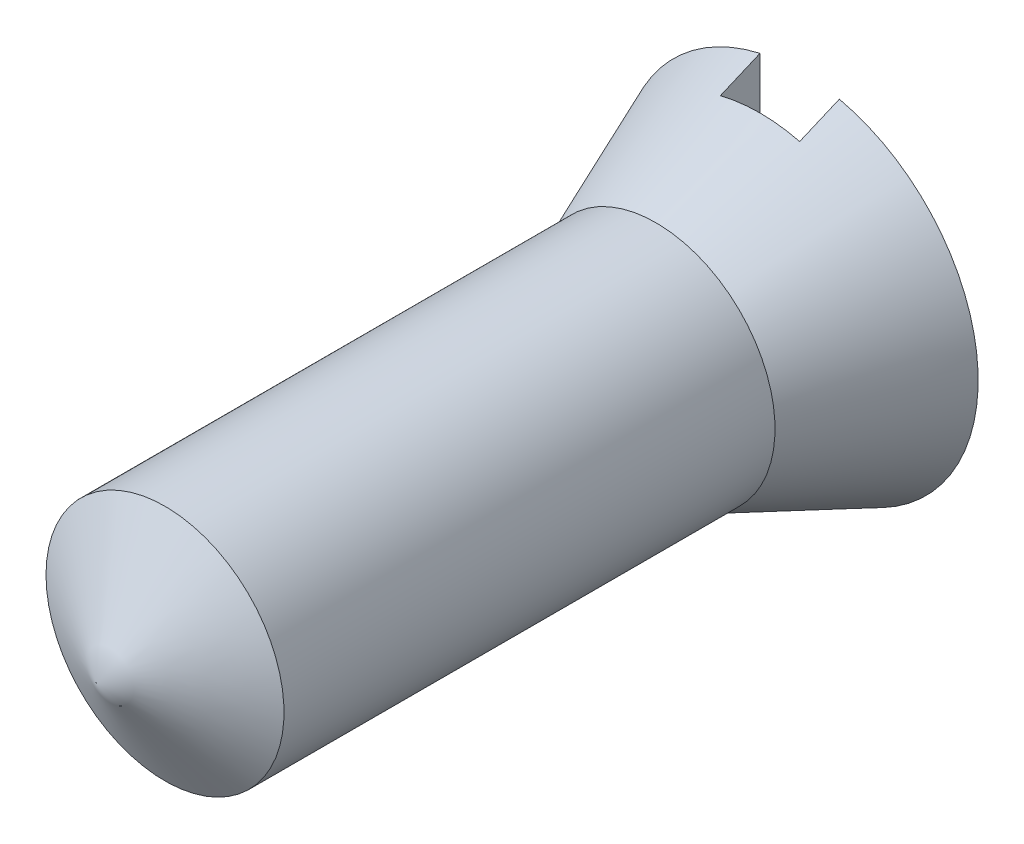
SolidWorks part; units mm, degrees
ref_plane "Front Plane" through (0, 0, 0) normal (0, 0, 1) x (1, 0, 0)
ref_plane "Top Plane" through (0, 0, 0) normal (0, 1, 0) x (1, 0, 0)
ref_plane "Right Plane" through (0, 0, 0) normal (1, 0, 0) x (0, 0, -1)
sketch "Sketch1" plane through (0, 0, 0) normal (0, 1, 0) x (1, 0, 0)
  line L0 (0, 0) -> (0, 17.7321)
  line L1 (0, 17.7321) -> (4.5, 17.7321)
  line L2 (4.5, 17.7321) -> (3, 14.1107)
  line L3 (3, 14.1107) -> (3, 1.7321)
  line L4 (3, 1.7321) -> (0, 0)
  line L5 (0, 0) -> (0, -5.5994) construction
  line L6 (13.1251, 17.7321) -> (4.5, 17.7321) construction
  line L7 (4.5, 17.7321) -> (7.4834, 24.9345) construction
  line L8 (-4.5, 17.7321) -> (-3, 14.1107) construction
  dimension "D1" = 9
  dimension "D2" = 6
  dimension "D3" = 120
  dimension "D4" = 16
  dimension "D5" = 45
revolve "Revolve1" add sketch "Sketch1" angle 360 about L5
sketch "Sketch2" plane through (0, 0, -17.7321) normal (0, 0, -1) x (-1, 0, 0)
  line L1 (-1, -5.2264) -> (1, -5.2264)
  line L2 (-1, -5.2264) -> (-1, 5.2264)
  line L3 (-1, 5.2264) -> (1, 5.2264)
  line L4 (1, -5.2264) -> (1, 5.2264)
  line L5 (-1, -5.2264) -> (1, 5.2264) construction
  line L6 (-1, 5.2264) -> (1, -5.2264) construction
  point P0 (0, 0)
  dimension "D1" = 2
extrude "Cut-Extrude1" cut sketch "Sketch2" against normal blind 1
